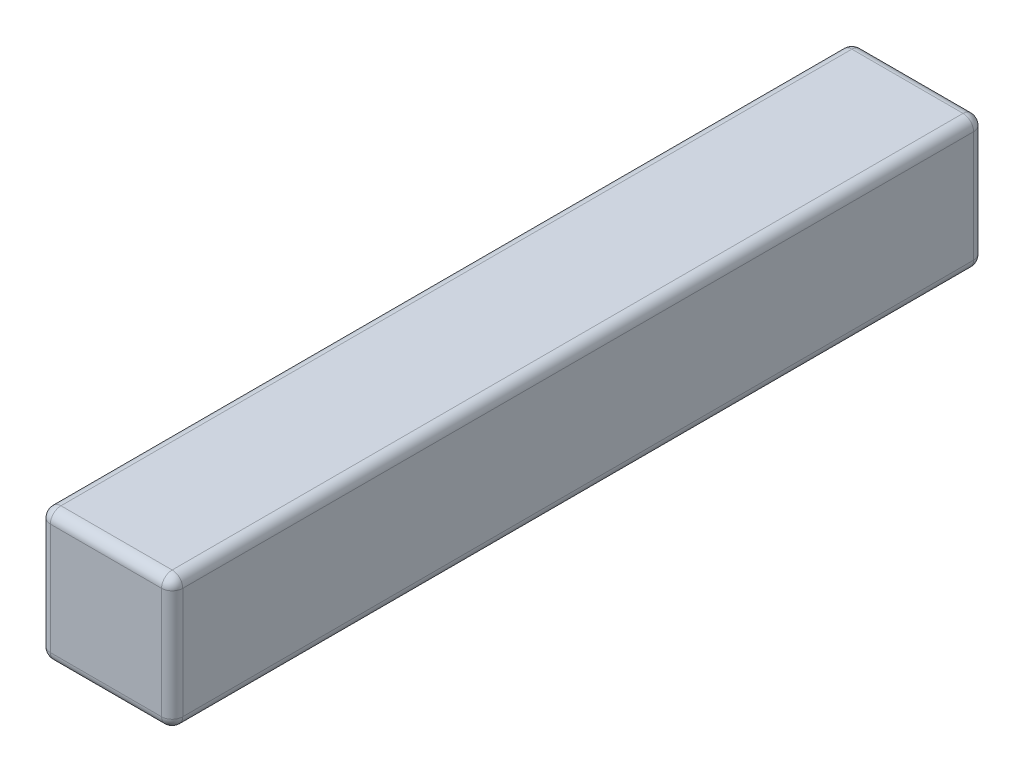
SolidWorks part; units mm, degrees
ref_plane "Front Plane" through (0, 0, 0) normal (0, 0, 1) x (1, 0, 0)
ref_plane "Top Plane" through (0, 0, 0) normal (0, 1, 0) x (1, 0, 0)
ref_plane "Right Plane" through (0, 0, 0) normal (1, 0, 0) x (0, 0, -1)
sketch "Sketch1" plane through (0, 0, 0) normal (0, 0, 1) x (1, 0, 0)
  line L1 (-18.75, 18.75) -> (18.75, 18.75)
  line L2 (-18.75, 18.75) -> (-18.75, -18.75)
  line L3 (-18.75, -18.75) -> (18.75, -18.75)
  line L4 (18.75, 18.75) -> (18.75, -18.75)
  line L5 (-18.75, 18.75) -> (18.75, -18.75) construction
  line L6 (-18.75, -18.75) -> (18.75, 18.75) construction
  point P0 (0, 0)
  dimension "D1" = 37.5
  dimension "D2" = 37.5
extrude "Boss-Extrude1" add sketch "Sketch1" along normal mid plane 230
fillet "Fillet1" radius 3 12 edges at (0, -18.75, -115) (-18.75, -18.75, 0) (-18.75, 0, -115) (0, -18.75, 115) (-18.75, 0, 115) (18.75, -18.75, 0) (18.75, 0, 115) (18.75, 0, -115) (18.75, 18.75, 0) (0, 18.75, 115) (-18.75, 18.75, 0) (0, 18.75, -115)
